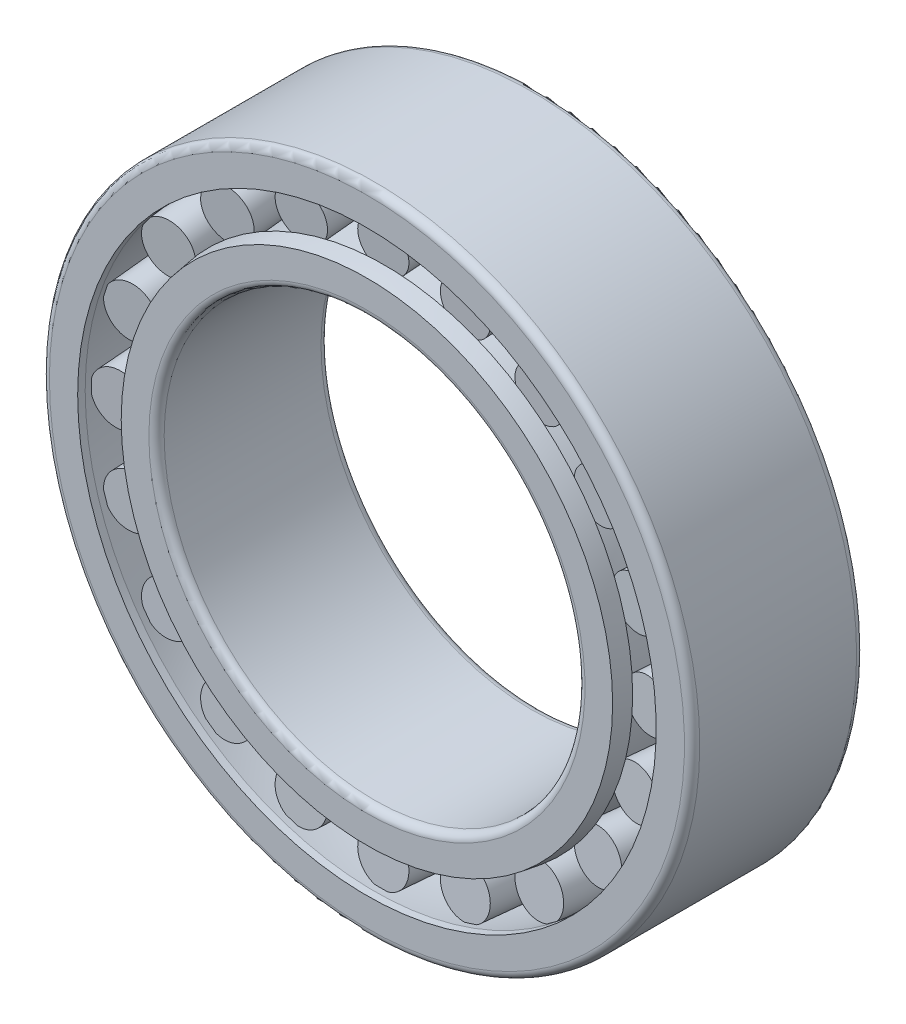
SolidWorks part; units mm, degrees
ref_plane "Front Plane" through (0, 0, 0) normal (0, 0, 1) x (1, 0, 0)
ref_plane "Top Plane" through (0, 0, 0) normal (0, 1, 0) x (1, 0, 0)
ref_plane "Right Plane" through (0, 0, 0) normal (1, 0, 0) x (0, 0, -1)
other "Configuration Table"
sketch "BaseSke" plane through (0, 0, 0) normal (1, 0, 0) x (0, 0, -1)
  line L0 (-47.2296, 0) -> (69.4868, 0) construction
  line L2 (0, 129.5214) -> (0, 77.0526) construction
  line L3 (-22.5, 55) -> (-22.5, 64.2308) construction
  line L4 (-22.5, 85) -> (22.5, 85) construction
  line L5 (-22.5, 55) -> (22.5, 55) construction
  line L7 (22.5, 55) -> (22.5, 64.2308) construction
  line L8 (22.5, 75.3077) -> (22.5, 85) construction
  line L9 (-22.5, 75.3077) -> (-22.5, 85) construction
  line L11 (0, 71.5858) -> (-22.5, 69.7692) construction
  line L12 (0, 71.5858) -> (22.5, 69.7692) construction
  line L13 (-22.5, 75.3077) -> (-22.5, 64.2308) construction
  line L14 (0, 66.119) -> (0, -86.3012) construction
  line L15 (0, 77.0526) -> (0, 66.119) construction
  line L16 (-18.213, 69.3629) -> (-17.6761, 62.7121) construction
  line L17 (-18.75, 76.0137) -> (-3.7987, 77.2208)
  line L18 (-18.75, 76.0137) -> (-18.213, 69.3629)
  line L19 (-17.6761, 62.7121) -> (-2.7247, 63.9193) construction
  line L20 (-3.7987, 77.2208) -> (-3.2617, 70.57)
  line L21 (-2.7247, 63.9193) -> (-3.2617, 70.57) construction
  line L22 (-18.213, 69.3629) -> (-3.2617, 70.57)
  line L23 (-22.5, 69.0168) -> (0, 70.8334) construction
  arc A1 (-22.5, 75.3077) -> (22.5, 75.3077) centre (0, -68.881) cw construction
  arc A2 (22.5, 64.2308) -> (-22.5, 64.2308) centre (0, -68.881) ccw construction
revolve "Roller" add sketch "BaseSke" angle 360 about L23
sketch "OuterRaceSke" plane through (0, 0, 0) normal (1, 0, 0) x (0, 0, -1)
  line L0 (0, 0) -> (0, 94.5438) construction
  line L1 (-22.5, 85) -> (22.5, 85)
  line L2 (-22.5, 85) -> (-22.5, 75.2875)
  line L3 (22.5, 85) -> (22.5, 75.2875)
  line L5 (-50.3916, 0) -> (55.2197, 0) construction
  arc A0 (-22.5, 75.2875) -> (22.5, 75.2875) centre (0, -68.881) cw
  arc A2 (22.5, 75.3077) -> (-22.5, 75.3077) centre (0, -68.881) ccw construction
  dimension "D1" = 0.02
revolve "OuterRace" add sketch "OuterRaceSke" angle 360 about L5
sketch "InnerRaceSke" plane through (0, 0, 0) normal (1, 0, 0) x (0, 0, -1)
  line L0 (-70.8626, 0) -> (113.5527, 0) construction
  line L1 (0, 90.393) -> (0, -90.393) construction
  line L2 (-22.5, 55) -> (22.5, 55)
  line L3 (-22.5, 55) -> (-22.5, 64.2308)
  line L4 (-17.9546, 64.9197) -> (-17.7774, 62.724)
  line L5 (-17.7774, 62.724) -> (-2.6267, 63.9472)
  line L7 (-2.6267, 63.9472) -> (-2.7997, 66.0899)
  line L8 (-18.213, 69.3629) -> (-17.6761, 62.7121) construction
  line L9 (2.6267, 63.9472) -> (2.7997, 66.0899)
  line L10 (-2.7247, 63.9193) -> (-3.2617, 70.57) construction
  line L11 (-17.6761, 62.7121) -> (-2.7247, 63.9193) construction
  line L14 (17.7774, 62.724) -> (2.6267, 63.9472)
  line L15 (17.9546, 64.9197) -> (17.7774, 62.724)
  line L16 (22.5, 55) -> (22.5, 64.2308)
  arc A0 (-22.5, 64.2308) -> (-17.9546, 64.9197) centre (0, -68.881) cw
  arc A1 (22.5, 64.2308) -> (-22.5, 64.2308) centre (0, -68.881) ccw construction
  arc A2 (-2.7997, 66.0899) -> (2.7997, 66.0899) centre (0, -68.881) cw
  arc A3 (22.5, 64.2308) -> (17.9546, 64.9197) centre (0, -68.881) ccw
  point P38 (0, 55)
  dimension "D2" = 0.1
  dimension "D1" = 0.02
  dimension "D3" = 0.1
revolve "InnerRace" add sketch "InnerRaceSke" angle 360 about L0
mirror "MirrorRoller" about plane through (0, 0, 0) normal (0, 0, 1) of "Roller"
fillet "Fillet1" radius 2 4 edges at (55, 0, 22.5) (85, 0, 22.5) (55, 0, -22.5) (85, 0, -22.5)
sketch "CutGrooveSke" plane through (0, 0, 0) normal (1, 0, 0) x (0, 0, -1)
  line L0 (-51.8407, 0) -> (83.8302, 0) construction
  line L1 (-11.25, -103.3) -> (-13.5, -103.3)
  line L2 (-11.25, -103.3) -> (-11.25, -83.3)
  line L3 (-11.25, -83.3) -> (-13.5, -83.3)
  line L4 (-13.5, -103.3) -> (-13.5, -83.3)
revolve "CutGroove" [suppressed] cut sketch "CutGrooveSke" angle 360 about L0
sketch "TaperSke" plane through (0, 0, 0) normal (1, 0, 0) x (0, 0, -1)
  line L0 (-22.5, 55) -> (22.5, 55)
  line L1 (22.5, 55) -> (22.5, 58.75)
  line L2 (22.5, 58.75) -> (-22.5, 55)
  line L7 (-41.2502, 0) -> (40.8606, 0) construction
revolve "Taper" [suppressed] cut sketch "TaperSke" angle 360 about L7
fillet "Fillet2" [suppressed] radius 2
pattern_circular "CirPatternBall" count 20 over 360 about axis through (0, 0, 0) along (0, 0, 1) of "Roller", "MirrorRoller"
sketch "SimplifiedSke" plane through (0, 0, 0) normal (1, 0, 0) x (0, 0, -1)
  line L0 (37.5911, 0) -> (-37.5911, 0) construction
  line L1 (0, 0) -> (0, 96.8272) construction
  line L2 (-17.6761, 62.7121) -> (-2.7247, 63.9193)
  line L3 (-17.6761, 62.7121) -> (-18.75, 76.0137)
  line L4 (-18.75, 76.0137) -> (-3.7987, 77.2208)
  line L5 (-2.7247, 63.9193) -> (-3.7987, 77.2208)
  line L7 (2.7247, 63.9193) -> (3.7987, 77.2208)
  line L8 (17.6761, 62.7121) -> (2.7247, 63.9193)
  line L9 (17.6761, 62.7121) -> (18.75, 76.0137)
  line L10 (18.75, 76.0137) -> (3.7987, 77.2208)
revolve "Simplified" [suppressed] add sketch "SimplifiedSke" angle 360 about L0
chamfer "Chamfer" distance 1.875 angle 10 2 edges at (75.2875, 0, -22.5) (75.2875, 0, 22.5)
equation "\"D1@BaseSke\" = \"Bearing_Thickness@BaseSke\"*3"
equation "\"D2@BaseSke\" =  ( \"Bearing_Outside_Diameter@BaseSke\" - \"Bearing_Inside_Diameter@BaseSke\" ) /6.5"
equation "\"D3@BaseSke\" = \"D2@BaseSke\"*1.05"
equation "\"D4@BaseSke\" = \"Bearing_Thickness@BaseSke\"/3"
equation "\"D5@BaseSke\" = \"Bearing_Thickness@BaseSke\"/12"
equation "\"D6@BaseSke\" = \"Bearing_Thickness@BaseSke\"/60"
equation "\"D1@CutGrooveSke\" = \"Bearing_Outside_Diameter@BaseSke\" * 0.49"
equation "\"D2@CutGrooveSke\" = \"Bearing_Thickness@BaseSke\" *0.25"
equation "\"D3@CutGrooveSke\" = \"Bearing_Thickness@BaseSke\"/20"
equation "\"Taper@TaperSke\" = \"Bearing_Thickness@BaseSke\"/12"
equation "\"D1@Fillet2\" = \"Fillet_radius@Fillet1\""
equation "\"D1@CirPatternBall\" =  int(  ( \"Bearing_Outside_Diameter@BaseSke\" + \"Bearing_Inside_Diameter@BaseSke\" )  / 2 *  pi  /  ( \"Bearing_Outside_Diameter@BaseSke\" - \"Bearing_Inside_Diameter@BaseSke\" ) * 2.8 "
equation "\"D1@Chamfer\" = \"Bearing_Thickness@BaseSke\"/24"
